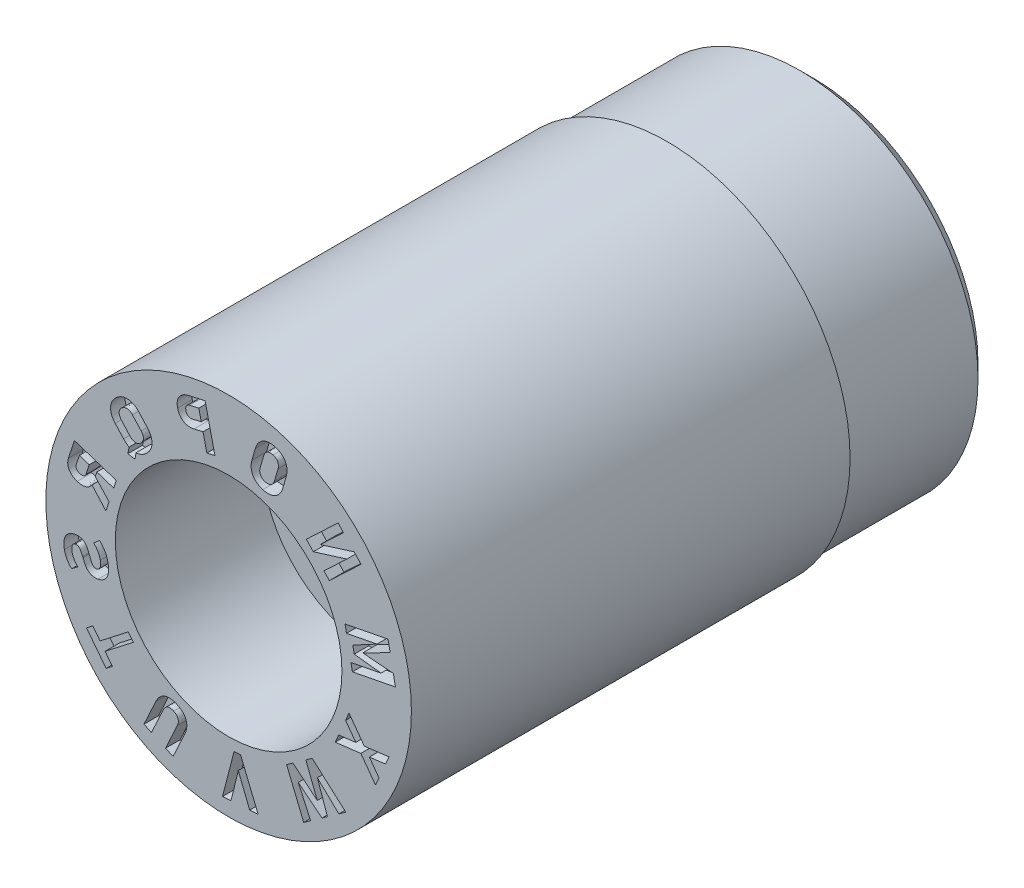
SolidWorks part; units mm, degrees
ref_plane "Front Plane" through (0, 0, 0) normal (0, 0, 1) x (1, 0, 0)
ref_plane "Top Plane" through (0, 0, 0) normal (0, 1, 0) x (1, 0, 0)
ref_plane "Right Plane" through (0, 0, 0) normal (1, 0, 0) x (0, 0, -1)
sketch "Sketch1" plane through (0, 0, 0) normal (1, 0, 0) x (0, 0, -1)
  line L2 (0, 2.5) -> (0, 1.55)
  line L3 (7.75, 2.5) -> (0, 2.5)
  line L4 (-3.7979, 0) -> (49996.2021, 0) construction
  line L8 (8, 0.8) -> (2, 0.8)
  line L9 (2, 1.55) -> (2, 0.8)
  line L10 (2, 1.55) -> (0, 1.55)
  line L12 (8, 0.8) -> (8, 2.25)
  line L16 (8, 2.25) -> (7.75, 2.5)
  dimension "D1" = 8
  dimension "D2" = 45
  dimension "D3" = 0.25
  dimension "D4" = 5
  dimension "D5" = 3.1
  dimension "D6" = 2
  dimension "D7" = 1.6
revolve "Revolve1" add sketch "Sketch1" angle 360 about L4
sketch "Sketch4" plane through (0, 0, 0) normal (1, 0, 0) x (0, 0, -1)
  line L0 (0, 0) -> (50000, 0) construction
  line L1 (8, -2.25) -> (8, 2.25) construction
  line L2 (6, 3.435) -> (8, 3.435)
  line L3 (6, 3.435) -> (6, 2.435)
  line L4 (6, 2.435) -> (8, 2.435)
  line L5 (8, 3.435) -> (8, 2.435)
  line L6 (7.75, 2.5) -> (0, 2.5) construction
  line L7 (0, 2.5) -> (0, -2.5) construction
  dimension "D1" = 1
  dimension "D2" = 0.065
  dimension "D3" = 6
revolve "Cut-Revolve1" cut sketch "Sketch4" angle 360 about L0
sketch "Sketch6" plane through (0, 0, 0) normal (0, 0, 1) x (1, 0, 0)
  line L0 (2.2094, 0.5504) -> (2.1808, 0.6966)
  line L1 (2.1808, 0.6966) -> (1.5921, 0.5815)
  line L2 (1.5921, 0.5815) -> (1.6118, 0.4807)
  line L3 (1.6118, 0.4807) -> (2.0297, 0.5623)
  line L5 (2.0297, 0.5623) -> (1.6986, 0.385)
  line L6 (1.6986, 0.385) -> (1.7178, 0.2871)
  line L7 (1.7178, 0.2871) -> (2.0838, 0.2458)
  line L9 (2.0838, 0.2458) -> (1.6733, 0.1656)
  line L10 (1.6733, 0.1656) -> (1.6931, 0.0648)
  line L11 (1.6931, 0.0648) -> (2.2818, 0.1798)
  line L12 (2.2818, 0.1798) -> (2.2532, 0.326)
  line L13 (2.2532, 0.326) -> (1.8345, 0.3606)
  line L14 (1.8345, 0.3606) -> (2.2094, 0.5504)
  line L15 (1.8117, 1.399) -> (1.7171, 1.499)
  line L16 (1.7171, 1.499) -> (1.2532, 1.3527)
  line L18 (1.2532, 1.3527) -> (1.5711, 1.6533)
  line L19 (1.5711, 1.6533) -> (1.4972, 1.7314)
  line L20 (1.4972, 1.7314) -> (1.0635, 1.3211)
  line L21 (1.0635, 1.3211) -> (1.1586, 1.2206)
  line L22 (1.1586, 1.2206) -> (1.6167, 1.3628)
  line L24 (1.6167, 1.3628) -> (1.304, 1.0669)
  line L25 (1.304, 1.0669) -> (1.378, 0.9887)
  line L26 (1.378, 0.9887) -> (1.8117, 1.399)
  line L27 (0.7405, 1.7626) -> (0.788, 1.9264)
  line L28 (0.366, 2.0488) -> (0.3185, 1.885)
  line L29 (0.4307, 1.8497) -> (0.4797, 2.019)
  line L30 (0.676, 1.962) -> (0.6269, 1.7927)
  line L31 (-0.374, 1.9935) -> (-0.5008, 1.9642)
  line L32 (-0.5343, 2.1095) -> (-0.4075, 2.1387)
  line L33 (-0.3496, 1.8876) -> (-0.2975, 1.6612)
  line L34 (-0.3219, 2.2699) -> (-0.5559, 2.2161)
  line L35 (-0.4736, 1.859) -> (-0.3496, 1.8876)
  line L36 (-1.8023, 0.6851) -> (-1.5721, 0.6102)
  line L38 (-0.4075, 2.1387) -> (-0.374, 1.9935)
  line L39 (-0.2975, 1.6612) -> (-0.1875, 1.6865)
  line L40 (-0.1875, 1.6865) -> (-0.3219, 2.2699)
  line L41 (-1.7586, -1.2943) -> (-1.8584, -1.1657)
  line L42 (-1.3614, 1.202) -> (-1.3781, 1.1131)
  line L43 (-1.3781, 1.1131) -> (-1.2818, 1.0966)
  line L44 (-1.2818, 1.0966) -> (-1.266, 1.1813)
  line L45 (-1.1118, 1.5552) -> (-1.2262, 1.6813)
  line L46 (-1.5513, 1.3863) -> (-1.4368, 1.2602)
  line L47 (-1.3479, 1.3368) -> (-1.4662, 1.4673)
  line L48 (-1.315, 1.6045) -> (-1.1967, 1.474)
  line L49 (-1.9063, 0.719) -> (-1.95, 0.5847)
  line L50 (-2.0847, 0.6284) -> (-2.041, 0.7628)
  line L52 (-2.1098, 0.9045) -> (-2.1913, 0.6537)
  line L53 (-1.8237, 0.6196) -> (-1.8023, 0.6851)
  line L56 (-2.041, 0.7628) -> (-1.9063, 0.719)
  line L57 (-1.5721, 0.6102) -> (-1.5369, 0.7181)
  line L58 (-1.5369, 0.7181) -> (-2.1098, 0.9045)
  line L60 (-1.8694, 0.4986) -> (-1.6779, 0.2849)
  line L61 (-1.6779, 0.2849) -> (-1.6353, 0.4157)
  line L62 (-1.6353, 0.4157) -> (-1.8237, 0.6196)
  line L63 (-1.7657, -0.1087) -> (-1.8472, -0.178)
  line L64 (-1.8041, -0.4647) -> (-1.8044, -0.4649)
  line L65 (-1.8955, -0.3707) -> (-1.8985, -0.3621)
  line L66 (-2.1074, -0.2042) -> (-2.1079, -0.2043)
  line L67 (-2.1479, -0.6339) -> (-2.0631, -0.5687)
  line L68 (-2.097, -0.3166) -> (-2.0967, -0.3165)
  line L69 (-1.7855, -0.5755) -> (-1.7846, -0.5753)
  line L71 (-1.6895, -1.3831) -> (-1.3033, -1.0829)
  line L72 (-1.3033, -1.0829) -> (-1.3723, -0.9941)
  line L73 (-1.3723, -0.9941) -> (-1.7586, -1.2943)
  line L74 (-1.9441, -1.2323) -> (-1.6753, -1.5782)
  line L75 (-1.6753, -1.5782) -> (-1.5896, -1.5117)
  line L76 (-1.5896, -1.5117) -> (-1.6895, -1.3831)
  line L77 (-1.8584, -1.1657) -> (-1.9441, -1.2323)
  line L78 (-0.997, -1.6325) -> (-1.1579, -1.9802)
  line L79 (-1.1579, -1.9802) -> (-1.0552, -2.0276)
  line L80 (-1.0552, -2.0276) -> (-0.8931, -1.6773)
  line L81 (-0.7006, -1.7664) -> (-0.8627, -2.1168)
  line L82 (-0.8627, -2.1168) -> (-0.76, -2.1642)
  line L83 (-0.76, -2.1642) -> (-0.5991, -1.8165)
  line L84 (-0.084, -2.3005) -> (0.0324, -2.2925)
  line L85 (0.0324, -2.2925) -> (0.1325, -1.8836)
  line L86 (0.1325, -1.8836) -> (0.2874, -2.275)
  line L87 (0.2874, -2.275) -> (0.4038, -2.267)
  line L88 (0.4038, -2.267) -> (0.163, -1.6808)
  line L89 (0.163, -1.6808) -> (0.0746, -1.6869)
  line L90 (0.0746, -1.6869) -> (-0.084, -2.3005)
  line L91 (1.278, -1.8735) -> (1.3519, -1.8211)
  line L92 (1.3519, -1.8211) -> (1.2138, -1.429)
  line L93 (1.2138, -1.429) -> (1.5081, -1.7101)
  line L94 (1.5081, -1.7101) -> (1.6028, -1.6429)
  line L95 (1.6028, -1.6429) -> (1.1434, -1.2344)
  line L96 (1.1434, -1.2344) -> (1.0566, -1.296)
  line L97 (1.0566, -1.296) -> (1.2123, -1.6988)
  line L98 (1.2123, -1.6988) -> (0.8794, -1.4219)
  line L99 (0.8794, -1.4219) -> (0.7927, -1.4834)
  line L100 (0.7927, -1.4834) -> (1.0271, -2.0517)
  line L101 (1.0271, -2.0517) -> (1.1217, -1.9844)
  line L102 (1.1217, -1.9844) -> (0.9531, -1.6141)
  line L103 (0.9531, -1.6141) -> (1.278, -1.8735)
  line L105 (1.8088, -0.8426) -> (2.0096, -1.1182)
  line L106 (2.0096, -1.1182) -> (2.0567, -1.0088)
  line L107 (2.0567, -1.0088) -> (1.9249, -0.8281)
  line L109 (1.8554, -0.7332) -> (1.6466, -0.4464)
  line L110 (1.6466, -0.4464) -> (1.5996, -0.5557)
  line L111 (1.5996, -0.5557) -> (1.7396, -0.7476)
  line L112 (1.9249, -0.8281) -> (2.1462, -0.8007)
  line L113 (2.1462, -0.8007) -> (2.1932, -0.6914)
  line L114 (2.1932, -0.6914) -> (1.8554, -0.7332)
  line L115 (1.7396, -0.7476) -> (1.5046, -0.7768)
  line L116 (1.5046, -0.7768) -> (1.4575, -0.8861)
  line L117 (1.4575, -0.8861) -> (1.8088, -0.8426)
  spline S0 degree 3 poles (0.4678, 1.6108) (0.4779, 1.6079) (0.4932, 1.6044) (0.5137, 1.6013) (0.5286, 1.6001) (0.5433, 1.6) (0.5578, 1.6006) (0.5721, 1.6023) (0.586, 1.605) (0.5997, 1.6086) (0.6129, 1.613) (0.6256, 1.6184) (0.6378, 1.6247) (0.6496, 1.6317) (0.6609, 1.6397) (0.6716, 1.6487) (0.682, 1.6583) (0.6917, 1.6688) (0.7007, 1.6802) (0.7092, 1.6921) (0.7168, 1.7049) (0.7238, 1.7182) (0.7324, 1.7373) (0.7376, 1.7523) (0.7405, 1.7626) knots 0 0 0 0 0.090323 0.133749 0.176212 0.2179 0.259091 0.299875 0.340463 0.380322 0.420128 0.459098 0.498219 0.537095 0.576227 0.616035 0.656264 0.696913 0.737846 0.779625 0.821712 0.864623 0.908536 1 1 1 1
  spline S1 degree 3 poles (0.788, 1.9264) (0.791, 1.9367) (0.7945, 1.9522) (0.7978, 1.9729) (0.7988, 1.988) (0.7994, 2.0028) (0.7985, 2.0174) (0.797, 2.0317) (0.7944, 2.0458) (0.791, 2.0596) (0.7865, 2.0728) (0.7813, 2.0856) (0.7751, 2.0979) (0.7681, 2.1098) (0.7603, 2.1211) (0.7515, 2.1319) (0.7419, 2.1422) (0.7315, 2.152) (0.7204, 2.161) (0.7085, 2.1694) (0.696, 2.1771) (0.6827, 2.184) (0.6639, 2.1926) (0.649, 2.1976) (0.6389, 2.2006) knots 0 0 0 0 0.091424 0.135489 0.178425 0.22053 0.261925 0.302982 0.343591 0.38393 0.423739 0.462911 0.501914 0.54095 0.58022 0.619478 0.65971 0.700085 0.741061 0.782148 0.823884 0.866451 0.90963 1 1 1 1
  spline S2 degree 3 poles (0.6389, 2.2006) (0.6288, 2.2037) (0.6134, 2.2071) (0.593, 2.2101) (0.578, 2.2114) (0.5633, 2.2115) (0.5488, 2.2109) (0.5345, 2.2092) (0.5205, 2.2065) (0.5068, 2.2031) (0.4937, 2.1985) (0.4809, 2.1931) (0.4687, 2.187) (0.4569, 2.1797) (0.4457, 2.1718) (0.4348, 2.1629) (0.4246, 2.1531) (0.4148, 2.1426) (0.4058, 2.1313) (0.3973, 2.1194) (0.3898, 2.1066) (0.3827, 2.0932) (0.3741, 2.0741) (0.369, 2.0591) (0.366, 2.0488) knots 0 0 0 0 0.090266 0.133661 0.176402 0.21806 0.259222 0.299977 0.340537 0.380605 0.420165 0.459107 0.498378 0.537072 0.576498 0.616055 0.656507 0.697127 0.738032 0.779781 0.821838 0.864718 0.908601 1 1 1 1
  spline S3 degree 3 poles (0.3185, 1.885) (0.3155, 1.8747) (0.312, 1.8592) (0.3087, 1.8386) (0.3075, 1.8235) (0.3071, 1.8087) (0.308, 1.7941) (0.3096, 1.7797) (0.3121, 1.7657) (0.3156, 1.752) (0.3199, 1.7387) (0.3252, 1.7259) (0.3313, 1.7136) (0.3382, 1.7017) (0.3463, 1.6905) (0.3549, 1.6795) (0.3647, 1.6693) (0.375, 1.6594) (0.3862, 1.6505) (0.398, 1.6421) (0.4106, 1.6344) (0.4239, 1.6275) (0.4427, 1.6188) (0.4577, 1.614) (0.4678, 1.6108) knots 0 0 0 0 0.091393 0.135443 0.178203 0.220472 0.261853 0.302897 0.343493 0.383579 0.423326 0.462484 0.501475 0.540498 0.579619 0.619306 0.659524 0.699885 0.740808 0.781881 0.823602 0.866155 0.909665 1 1 1 1
  spline S4 degree 3 poles (0.4994, 1.7198) (0.49, 1.7224) (0.4768, 1.728) (0.4611, 1.7382) (0.4511, 1.747) (0.4426, 1.757) (0.4357, 1.7681) (0.4305, 1.7801) (0.427, 1.7929) (0.425, 1.8065) (0.4253, 1.8257) (0.4279, 1.8401) (0.4307, 1.8497) knots 0 0 0 0 0.175659 0.25764 0.337646 0.416588 0.495197 0.572823 0.653345 0.735605 0.820222 1 1 1 1
  spline S5 degree 3 poles (0.4797, 2.019) (0.4825, 2.0285) (0.488, 2.0421) (0.4982, 2.0584) (0.507, 2.0688) (0.5169, 2.0777) (0.5277, 2.0851) (0.5394, 2.0907) (0.552, 2.0944) (0.5653, 2.0966) (0.584, 2.0972) (0.5981, 2.0945) (0.6074, 2.0918) knots 0 0 0 0 0.180183 0.264367 0.346349 0.42679 0.504846 0.582497 0.661553 0.742625 0.82455 1 1 1 1
  spline S6 degree 3 poles (0.6074, 2.0918) (0.6167, 2.0893) (0.6299, 2.0836) (0.6456, 2.0735) (0.6555, 2.0645) (0.664, 2.0545) (0.671, 2.0435) (0.676, 2.0314) (0.6796, 2.0186) (0.6815, 2.0051) (0.6814, 1.9859) (0.6787, 1.9715) (0.676, 1.962) knots 0 0 0 0 0.175126 0.257195 0.338134 0.41716 0.494868 0.572993 0.653601 0.735949 0.82003 1 1 1 1
  spline S7 degree 3 poles (0.6269, 1.7927) (0.6241, 1.7831) (0.6186, 1.7695) (0.6084, 1.7532) (0.5996, 1.7428) (0.5897, 1.7338) (0.5789, 1.7265) (0.5672, 1.7208) (0.5546, 1.717) (0.5414, 1.7149) (0.5227, 1.7145) (0.5086, 1.717) (0.4994, 1.7198) knots 0 0 0 0 0.180244 0.264456 0.347198 0.427666 0.505072 0.583375 0.661977 0.742587 0.825154 1 1 1 1
  spline S8 degree 3 poles (-0.5008, 1.9642) (-0.507, 1.9629) (-0.5165, 1.9617) (-0.5289, 1.9628) (-0.5376, 1.9651) (-0.546, 1.9683) (-0.5536, 1.973) (-0.5608, 1.9785) (-0.5672, 1.9853) (-0.5729, 1.993) (-0.5792, 2.0048) (-0.5827, 2.0144) (-0.584, 2.0212) knots 0 0 0 0 0.168779 0.249596 0.328432 0.407062 0.48572 0.564814 0.646319 0.730711 0.817085 1 1 1 1
  spline S9 degree 3 poles (-0.584, 2.0212) (-0.5856, 2.0281) (-0.5871, 2.0383) (-0.5865, 2.0518) (-0.5849, 2.0613) (-0.5822, 2.0702) (-0.5783, 2.0785) (-0.5734, 2.0859) (-0.5674, 2.0925) (-0.5605, 2.0984) (-0.5497, 2.1048) (-0.5406, 2.1081) (-0.5343, 2.1095) knots 0 0 0 0 0.184525 0.269847 0.354276 0.436138 0.514601 0.592866 0.670246 0.748708 0.829399 1 1 1 1
  spline S10 degree 3 poles (-0.5559, 2.2161) (-0.5731, 2.2123) (-0.5978, 2.2038) (-0.6276, 2.187) (-0.6469, 2.1722) (-0.6639, 2.1555) (-0.6779, 2.1367) (-0.6892, 2.1162) (-0.6973, 2.0941) (-0.7026, 2.0706) (-0.705, 2.0372) (-0.702, 2.0118) (-0.698, 1.995) knots 0 0 0 0 0.179264 0.262914 0.345095 0.425467 0.504018 0.581987 0.661489 0.742357 0.824785 1 1 1 1
  spline S11 degree 3 poles (-0.698, 1.995) (-0.6941, 1.9781) (-0.6859, 1.9538) (-0.6689, 1.925) (-0.654, 1.9063) (-0.6369, 1.89) (-0.6179, 1.8767) (-0.5971, 1.8661) (-0.5746, 1.8583) (-0.5508, 1.8538) (-0.5168, 1.8516) (-0.4908, 1.855) (-0.4736, 1.859) knots 0 0 0 0 0.175741 0.257985 0.339044 0.418176 0.496191 0.574525 0.654742 0.736636 0.820446 1 1 1 1
  spline S12 degree 3 poles (-1.1254, 1.2435) (-1.1176, 1.2507) (-1.1065, 1.2617) (-1.0933, 1.2776) (-1.0846, 1.2897) (-1.0766, 1.3021) (-1.0696, 1.3148) (-1.0635, 1.3279) (-1.0584, 1.3412) (-1.0544, 1.3546) (-1.0511, 1.3682) (-1.0491, 1.3818) (-1.0481, 1.3955) (-1.0478, 1.4092) (-1.0487, 1.423) (-1.0508, 1.4368) (-1.0536, 1.4507) (-1.0575, 1.4645) (-1.0623, 1.4781) (-1.0681, 1.4916) (-1.0751, 1.5047) (-1.0827, 1.5177) (-1.0945, 1.535) (-1.1046, 1.5472) (-1.1118, 1.5552) knots 0 0 0 0 0.090273 0.133594 0.176012 0.217862 0.259154 0.300081 0.340506 0.380621 0.419929 0.459293 0.497912 0.536999 0.576116 0.615854 0.656238 0.696872 0.737957 0.779685 0.821655 0.864724 0.908462 1 1 1 1
  spline S13 degree 3 poles (-1.2262, 1.6813) (-1.2334, 1.6891) (-1.2446, 1.7004) (-1.2607, 1.7137) (-1.2728, 1.7228) (-1.2854, 1.7307) (-1.298, 1.738) (-1.3112, 1.7439) (-1.3244, 1.7492) (-1.3379, 1.7534) (-1.3515, 1.7565) (-1.3651, 1.7589) (-1.3788, 1.76) (-1.3926, 1.7602) (-1.4064, 1.7595) (-1.4202, 1.7576) (-1.434, 1.7549) (-1.4477, 1.7512) (-1.4612, 1.7464) (-1.4746, 1.7406) (-1.4877, 1.7341) (-1.5006, 1.7264) (-1.5176, 1.7147) (-1.5298, 1.7049) (-1.5376, 1.6977) knots 0 0 0 0 0.091297 0.135124 0.178219 0.220401 0.261852 0.3028 0.34334 0.383546 0.423219 0.462646 0.501628 0.540387 0.579814 0.619492 0.659462 0.699993 0.740636 0.781912 0.823821 0.866145 0.909637 1 1 1 1
  spline S14 degree 3 poles (-1.5376, 1.6977) (-1.5454, 1.6906) (-1.5566, 1.6795) (-1.5697, 1.6636) (-1.5787, 1.6516) (-1.5864, 1.6391) (-1.5935, 1.6265) (-1.5994, 1.6134) (-1.6045, 1.6002) (-1.6086, 1.5867) (-1.6118, 1.5731) (-1.6138, 1.5595) (-1.615, 1.5458) (-1.6151, 1.532) (-1.6142, 1.5182) (-1.6121, 1.5044) (-1.6093, 1.4906) (-1.6055, 1.4769) (-1.6006, 1.4633) (-1.5949, 1.4498) (-1.588, 1.4367) (-1.5803, 1.4238) (-1.5686, 1.4065) (-1.5584, 1.3943) (-1.5513, 1.3863) knots 0 0 0 0 0.090349 0.133707 0.176339 0.218067 0.259394 0.299912 0.340372 0.38052 0.420207 0.459257 0.498252 0.537401 0.576551 0.616323 0.656408 0.697077 0.738197 0.779487 0.821785 0.86461 0.908385 1 1 1 1
  spline S15 degree 3 poles (-1.4368, 1.2602) (-1.4296, 1.2523) (-1.4184, 1.2411) (-1.4024, 1.2277) (-1.3902, 1.2187) (-1.3778, 1.2106) (-1.368, 1.2053) (-1.3626, 1.2025) (-1.3614, 1.202) knots 0 0 0 0 0.091284 0.135589 0.1782 0.220535 0.261841 0.272808 0.272808 0.272808 0.272808
  spline S16 degree 3 poles (-1.2015, 1.3275) (-1.2088, 1.3211) (-1.2202, 1.3124) (-1.2371, 1.3046) (-1.2499, 1.3008) (-1.2628, 1.2986) (-1.2759, 1.2985) (-1.2888, 1.3004) (-1.3015, 1.3041) (-1.314, 1.3097) (-1.3305, 1.3194) (-1.3411, 1.3296) (-1.3479, 1.3368) knots 0 0 0 0 0.175398 0.257632 0.337601 0.417103 0.494483 0.573001 0.652816 0.735412 0.819808 1 1 1 1
  spline S17 degree 3 poles (-1.4662, 1.4673) (-1.473, 1.4745) (-1.4816, 1.4864) (-1.49, 1.5035) (-1.4943, 1.5165) (-1.4968, 1.5295) (-1.4974, 1.5426) (-1.496, 1.5555) (-1.4929, 1.5683) (-1.4876, 1.5806) (-1.4784, 1.5968) (-1.4687, 1.6074) (-1.4615, 1.6139) knots 0 0 0 0 0.179565 0.263573 0.346064 0.426154 0.504635 0.582331 0.661652 0.742165 0.824284 1 1 1 1
  spline S18 degree 3 poles (-1.4615, 1.6139) (-1.4544, 1.6204) (-1.4428, 1.6289) (-1.4259, 1.6368) (-1.4131, 1.6406) (-1.4001, 1.6426) (-1.3871, 1.6427) (-1.3741, 1.641) (-1.3614, 1.6372) (-1.3489, 1.6317) (-1.3326, 1.6217) (-1.3217, 1.6118) (-1.315, 1.6045) knots 0 0 0 0 0.175372 0.257568 0.338184 0.417466 0.49481 0.57326 0.653764 0.735619 0.820296 1 1 1 1
  spline S19 degree 3 poles (-1.1967, 1.474) (-1.19, 1.4667) (-1.1814, 1.4548) (-1.1728, 1.4377) (-1.1685, 1.4248) (-1.166, 1.4117) (-1.1656, 1.3986) (-1.1669, 1.3857) (-1.1703, 1.3731) (-1.1754, 1.3607) (-1.1849, 1.3447) (-1.1943, 1.3338) (-1.2015, 1.3275) knots 0 0 0 0 0.18007 0.264455 0.346937 0.427019 0.50539 0.583078 0.661773 0.742277 0.824697 1 1 1 1
  spline S20 degree 3 poles (-1.95, 0.5847) (-1.9519, 0.5795) (-1.9551, 0.5718) (-1.9619, 0.5635) (-1.9677, 0.5581) (-1.9742, 0.5535) (-1.9815, 0.5501) (-1.9893, 0.5477) (-1.9978, 0.5463) (-2.0068, 0.5459) (-2.0195, 0.5468) (-2.0291, 0.5485) (-2.0355, 0.5506) knots 0 0 0 0 0.160903 0.236926 0.313023 0.389571 0.46656 0.546297 0.629364 0.716275 0.80646 1 1 1 1
  spline S21 degree 3 poles (-2.0355, 0.5506) (-2.0417, 0.5527) (-2.0508, 0.5564) (-2.0616, 0.5632) (-2.0686, 0.5689) (-2.0745, 0.5751) (-2.0797, 0.5816) (-2.0833, 0.5888) (-2.0862, 0.5962) (-2.0875, 0.604) (-2.0883, 0.6149) (-2.0863, 0.6231) (-2.0847, 0.6284) knots 0 0 0 0 0.192761 0.282732 0.369094 0.451826 0.530688 0.608348 0.685012 0.761064 0.837446 1 1 1 1
  spline S22 degree 3 poles (-2.1913, 0.6537) (-2.1964, 0.6388) (-2.2007, 0.6159) (-2.201, 0.5853) (-2.1976, 0.5636) (-2.1915, 0.5428) (-2.1823, 0.5232) (-2.1702, 0.505) (-2.1554, 0.4882) (-2.138, 0.4729) (-2.1108, 0.4549) (-2.0878, 0.4449) (-2.0716, 0.4396) knots 0 0 0 0 0.170966 0.251493 0.330727 0.409121 0.486425 0.564907 0.645709 0.729313 0.815308 1 1 1 1
  spline S23 degree 3 poles (-2.0716, 0.4396) (-2.0555, 0.4343) (-2.0311, 0.4289) (-1.9984, 0.4276) (-1.9754, 0.4297) (-1.9535, 0.4344) (-1.933, 0.4423) (-1.9139, 0.4527) (-1.8967, 0.4661) (-1.8816, 0.4814) (-1.8731, 0.4928) (-1.8694, 0.4986) knots 0 0 0 0 0.184562 0.2701 0.353928 0.434921 0.513703 0.591415 0.67036 0.749632 0.824815 0.824815 0.824815 0.824815
  spline S24 degree 3 poles (-1.6496, -0.3162) (-1.6525, -0.3023) (-1.6573, -0.2816) (-1.6663, -0.2548) (-1.674, -0.2353) (-1.6826, -0.2164) (-1.692, -0.1982) (-1.7025, -0.1809) (-1.7137, -0.1643) (-1.7257, -0.1488) (-1.7424, -0.1297) (-1.756, -0.1166) (-1.7657, -0.1087) knots 0 0 0 0 0.175447 0.262414 0.349208 0.435061 0.519211 0.602996 0.685533 0.766698 0.845686 1 1 1 1
  spline S25 degree 3 poles (-1.8472, -0.178) (-1.8357, -0.1877) (-1.8196, -0.2039) (-1.8011, -0.2283) (-1.7886, -0.2482) (-1.7775, -0.2692) (-1.7653, -0.2985) (-1.7586, -0.3213) (-1.7558, -0.3369) knots 0 0 0 0 0.241735 0.365132 0.491499 0.619116 0.746133 1 1 1 1
  spline S26 degree 3 poles (-1.7558, -0.3369) (-1.7541, -0.3454) (-1.752, -0.358) (-1.751, -0.3745) (-1.7509, -0.3858) (-1.7513, -0.3964) (-1.7528, -0.4065) (-1.7548, -0.4159) (-1.7577, -0.4246) (-1.7611, -0.4326) (-1.7652, -0.4398) (-1.7702, -0.446) (-1.7755, -0.4516) (-1.7817, -0.4562) (-1.791, -0.4612) (-1.7988, -0.4637) (-1.8041, -0.4647) knots 0 0 0 0 0.170855 0.249125 0.322961 0.392612 0.458073 0.521194 0.580691 0.637716 0.691216 0.742713 0.79314 0.84272 0.89333 1 1 1 1
  spline S27 degree 3 poles (-1.8044, -0.4649) (-1.8115, -0.4661) (-1.8223, -0.4671) (-1.8358, -0.4634) (-1.8445, -0.4589) (-1.8524, -0.4528) (-1.8595, -0.4456) (-1.866, -0.4373) (-1.8717, -0.4276) (-1.877, -0.4165) (-1.8849, -0.3991) (-1.8902, -0.3849) (-1.8938, -0.375) knots 0 0 0 0 0.155576 0.225864 0.295101 0.365091 0.437 0.511265 0.590691 0.677237 0.774094 1 1 1 1
  spline S28 degree 3 poles (-1.8938, -0.375) (-1.8941, -0.3743) (-1.8949, -0.3729) (-1.8951, -0.3714) (-1.8955, -0.3707) knots 0 0 0 0 0.499928 1 1 1 1
  spline S29 degree 3 poles (-1.8985, -0.3621) (-1.9048, -0.3445) (-1.9149, -0.3195) (-1.9295, -0.2885) (-1.9403, -0.2687) (-1.9524, -0.2511) (-1.9669, -0.2359) (-1.9837, -0.2225) (-1.9995, -0.2133) (-2.0133, -0.2071) (-2.0246, -0.2036) (-2.0366, -0.2011) (-2.0493, -0.1997) (-2.0628, -0.1992) (-2.0824, -0.2) (-2.0973, -0.2022) (-2.1074, -0.2042) knots 0 0 0 0 0.190487 0.274036 0.349278 0.419937 0.490749 0.562647 0.637505 0.676238 0.716029 0.757574 0.80102 0.84652 0.895086 1 1 1 1
  spline S30 degree 3 poles (-2.1079, -0.2043) (-2.1171, -0.2061) (-2.1306, -0.2094) (-2.1477, -0.2156) (-2.1596, -0.2209) (-2.1709, -0.2267) (-2.1815, -0.2335) (-2.1914, -0.2408) (-2.2006, -0.2488) (-2.2092, -0.2574) (-2.2168, -0.2668) (-2.224, -0.2766) (-2.2303, -0.2872) (-2.2358, -0.2983) (-2.2407, -0.31) (-2.2447, -0.3223) (-2.2481, -0.3352) (-2.2506, -0.3486) (-2.2524, -0.3626) (-2.2533, -0.3771) (-2.2534, -0.3921) (-2.253, -0.4076) (-2.2509, -0.4293) (-2.2484, -0.4457) (-2.2462, -0.4567) knots 0 0 0 0 0.086215 0.127066 0.166782 0.205913 0.243968 0.281848 0.319038 0.356118 0.393153 0.430353 0.467806 0.505752 0.544154 0.584006 0.62468 0.666649 0.709575 0.754131 0.799968 0.847487 0.896418 1 1 1 1
  spline S31 degree 3 poles (-2.2462, -0.4567) (-2.2441, -0.4674) (-2.2402, -0.4834) (-2.2328, -0.5042) (-2.2245, -0.5254) (-2.2116, -0.5511) (-2.1871, -0.5906) (-2.1645, -0.6175) (-2.1479, -0.6339) knots 0 0 0 0 0.158664 0.239684 0.322384 0.490623 0.659639 1 1 1 1
  spline S32 degree 3 poles (-2.0631, -0.5687) (-2.073, -0.5591) (-2.0865, -0.5436) (-2.1028, -0.5218) (-2.1135, -0.5049) (-2.1227, -0.4878) (-2.1326, -0.4652) (-2.1377, -0.4477) (-2.1401, -0.436) knots 0 0 0 0 0.265631 0.395425 0.524752 0.65041 0.770683 1 1 1 1
  spline S33 degree 3 poles (-2.1401, -0.436) (-2.1416, -0.428) (-2.1434, -0.4162) (-2.1447, -0.4008) (-2.1449, -0.3902) (-2.1443, -0.3802) (-2.1434, -0.3708) (-2.1414, -0.362) (-2.1389, -0.3539) (-2.1359, -0.3464) (-2.132, -0.3398) (-2.1277, -0.3339) (-2.1228, -0.3288) (-2.1171, -0.3245) (-2.1089, -0.3196) (-2.1018, -0.3177) (-2.097, -0.3166) knots 0 0 0 0 0.172879 0.25245 0.326376 0.396911 0.463615 0.526232 0.586252 0.643524 0.696953 0.747645 0.797427 0.846549 0.896144 1 1 1 1
  spline S34 degree 3 poles (-2.0967, -0.3165) (-2.0889, -0.3149) (-2.0773, -0.3144) (-2.0627, -0.318) (-2.0533, -0.323) (-2.045, -0.3296) (-2.0372, -0.337) (-2.0305, -0.3456) (-2.0244, -0.3554) (-2.0185, -0.3668) (-2.0095, -0.3859) (-2.003, -0.4016) (-1.9983, -0.4126) knots 0 0 0 0 0.156509 0.226936 0.295703 0.36593 0.436454 0.508011 0.581837 0.664611 0.762498 1 1 1 1
  spline S35 degree 3 poles (-1.9983, -0.4126) (-1.9978, -0.4136) (-1.9973, -0.4158) (-1.9963, -0.4178) (-1.9959, -0.4189) knots 0 0 0 0 0.491264 1 1 1 1
  spline S36 degree 3 poles (-1.9959, -0.4189) (-1.9954, -0.4204) (-1.994, -0.4233) (-1.9926, -0.4262) (-1.992, -0.4277) knots 0 0 0 0 0.506325 1 1 1 1
  spline S37 degree 3 poles (-1.992, -0.4277) (-1.9853, -0.4443) (-1.9749, -0.468) (-1.9593, -0.4971) (-1.9478, -0.5159) (-1.9353, -0.5325) (-1.9204, -0.5468) (-1.9037, -0.5591) (-1.8881, -0.5677) (-1.8747, -0.5732) (-1.8638, -0.5763) (-1.8523, -0.5787) (-1.8401, -0.5799) (-1.8273, -0.5803) (-1.809, -0.5795) (-1.795, -0.5772) (-1.7855, -0.5755) knots 0 0 0 0 0.189722 0.273551 0.349793 0.422393 0.494119 0.56699 0.642183 0.68127 0.720923 0.762359 0.805438 0.850289 0.897546 1 1 1 1
  spline S38 degree 3 poles (-1.7846, -0.5753) (-1.7756, -0.5736) (-1.7624, -0.5702) (-1.7455, -0.5641) (-1.7337, -0.5588) (-1.7225, -0.5528) (-1.7121, -0.5461) (-1.7024, -0.5385) (-1.6933, -0.5303) (-1.6848, -0.5215) (-1.6773, -0.5119) (-1.6702, -0.5018) (-1.6641, -0.4909) (-1.6586, -0.4796) (-1.654, -0.4675) (-1.6501, -0.4548) (-1.6469, -0.4414) (-1.6445, -0.4275) (-1.6428, -0.4131) (-1.6421, -0.3982) (-1.642, -0.3828) (-1.6426, -0.3669) (-1.6449, -0.3445) (-1.6474, -0.3275) (-1.6496, -0.3162) knots 0 0 0 0 0.083525 0.123446 0.162628 0.200524 0.23776 0.274953 0.311876 0.348744 0.385627 0.422714 0.460328 0.498245 0.537185 0.577339 0.618647 0.661287 0.705094 0.750037 0.796409 0.844663 0.894797 1 1 1 1
  spline S39 degree 3 poles (-0.7046, -1.5216) (-0.7148, -1.517) (-0.73, -1.5106) (-0.7506, -1.5043) (-0.7656, -1.5003) (-0.7804, -1.4977) (-0.7949, -1.4959) (-0.8092, -1.4951) (-0.8232, -1.4955) (-0.8369, -1.4968) (-0.8503, -1.499) (-0.8633, -1.5024) (-0.8761, -1.5064) (-0.8884, -1.5118) (-0.9003, -1.5182) (-0.9121, -1.5252) (-0.9233, -1.5335) (-0.9341, -1.5427) (-0.9445, -1.5528) (-0.9544, -1.5638) (-0.9639, -1.5758) (-0.973, -1.5886) (-0.9845, -1.6073) (-0.9924, -1.6221) (-0.997, -1.6325) knots 0 0 0 0 0.093952 0.138762 0.18215 0.224394 0.265246 0.305362 0.344705 0.383222 0.421592 0.459095 0.496557 0.534282 0.572304 0.610558 0.649833 0.689699 0.730346 0.771952 0.814684 0.858696 0.904234 1 1 1 1
  spline S40 degree 3 poles (-0.8931, -1.6773) (-0.8897, -1.6699) (-0.8841, -1.6593) (-0.8749, -1.6468) (-0.8679, -1.6385) (-0.8602, -1.6315) (-0.8523, -1.6252) (-0.8436, -1.6202) (-0.8346, -1.6161) (-0.8252, -1.613) (-0.8154, -1.6111) (-0.8054, -1.6103) (-0.7951, -1.6107) (-0.7845, -1.6121) (-0.7697, -1.6156) (-0.7589, -1.6199) (-0.7516, -1.6231) knots 0 0 0 0 0.141431 0.207199 0.269751 0.330156 0.388433 0.446085 0.503614 0.561221 0.618103 0.676609 0.735915 0.797226 0.861683 1 1 1 1
  spline S41 degree 3 poles (-0.7516, -1.6231) (-0.7444, -1.6265) (-0.734, -1.6321) (-0.7217, -1.6412) (-0.7137, -1.6483) (-0.7067, -1.656) (-0.7007, -1.6641) (-0.6959, -1.6729) (-0.692, -1.682) (-0.6892, -1.6915) (-0.6877, -1.7014) (-0.687, -1.7116) (-0.6875, -1.722) (-0.6891, -1.7328) (-0.693, -1.7478) (-0.697, -1.7591) (-0.7006, -1.7664) knots 0 0 0 0 0.139055 0.203713 0.26511 0.324542 0.382677 0.440362 0.49739 0.55468 0.612401 0.670523 0.730553 0.793677 0.859023 1 1 1 1
  spline S42 degree 3 poles (-0.5991, -1.8165) (-0.5945, -1.8061) (-0.5879, -1.7907) (-0.5813, -1.7697) (-0.5773, -1.7546) (-0.5744, -1.7396) (-0.5726, -1.7249) (-0.5716, -1.7104) (-0.5716, -1.6961) (-0.5727, -1.6822) (-0.5749, -1.6686) (-0.5779, -1.6554) (-0.582, -1.6426) (-0.5869, -1.6301) (-0.593, -1.6181) (-0.6, -1.6064) (-0.608, -1.5951) (-0.6169, -1.5842) (-0.6267, -1.5737) (-0.6374, -1.5637) (-0.6491, -1.5544) (-0.6616, -1.5453) (-0.6799, -1.5338) (-0.6946, -1.5264) (-0.7046, -1.5216) knots 0 0 0 0 0.095692 0.141037 0.18514 0.227874 0.269422 0.309971 0.34993 0.389283 0.427497 0.465731 0.503286 0.54096 0.578765 0.616694 0.655642 0.69513 0.735352 0.776149 0.818436 0.861569 0.906198 1 1 1 1
  spline S43 degree 3 poles (-1.266, 1.1813) (-1.2629, 1.1814) (-1.2552, 1.1819) (-1.2429, 1.1837) (-1.2291, 1.1864) (-1.2154, 1.1901) (-1.2018, 1.1948) (-1.1885, 1.2006) (-1.1754, 1.2072) (-1.1625, 1.2148) (-1.1455, 1.2266) (-1.1332, 1.2363) (-1.1254, 1.2435) knots 0.553532 0.553532 0.553532 0.553532 0.579887 0.619559 0.659523 0.700049 0.740686 0.781956 0.823565 0.866164 0.90965 1 1 1 1
extrude "Cut-Extrude1" cut sketch "Sketch6" against normal blind 0.2
